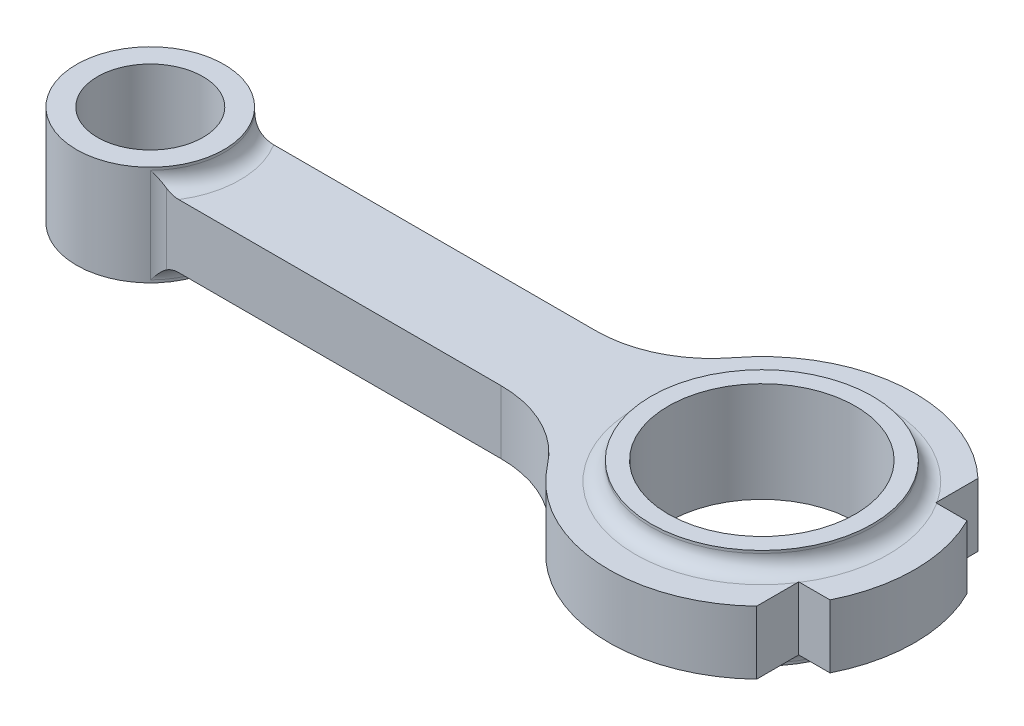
SolidWorks part; units mm, degrees
ref_plane "Front Plane" through (0, 0, 0) normal (0, 0, 1) x (1, 0, 0)
ref_plane "Top Plane" through (0, 0, 0) normal (0, 1, 0) x (1, 0, 0)
ref_plane "Right Plane" through (0, 0, 0) normal (1, 0, 0) x (0, 0, -1)
sketch "Sketch1" plane through (0, 0, 0) normal (0, 1, 0) x (1, 0, 0)
  line L0 (10.7238, 9) -> (75.5031, 9)
  line L1 (10.7238, -9) -> (75.5031, -9)
  line L2 (-1000, 0) -> (49000, 0) construction
  line L4 (136, 21) -> (136, 13)
  line L5 (136, 13) -> (141.923, 13)
  line L7 (136, -13) -> (141.923, -13)
  line L10 (136, -21) -> (136, -13)
  arc A0 (10.7238, 9) -> (10.7238, -9) centre (0, 0) ccw
  arc A1 (92.9723, -17.6275) -> (136, -21) centre (116, 0) ccw
  arc A2 (75.5031, 9) -> (92.9723, 17.6275) centre (75.5031, 31) ccw
  arc A3 (75.5031, -9) -> (92.9723, -17.6275) centre (75.5031, -31) cw
  arc A4 (141.923, -13) -> (141.923, 13) centre (116, 0) ccw
  arc A5 (136, 21) -> (92.9723, 17.6275) centre (116, 0) ccw
  point P1 (0, 0)
  point P20 (0, 0)
  point P21 (0, 0)
  dimension "D1" = 116
  dimension "D2" = 58
  dimension "D3" = 28
  dimension "D4" = 22
  dimension "D5" = 18
  dimension "D7" = 20
  dimension "D9" = 13
extrude "Boss-Extrude1" add sketch "Sketch1" along normal mid plane 12
sketch "Sketch2" plane through (0, 0, 0) normal (0, 1, 0) x (1, 0, 0)
  circle A0 centre (0, 0) radius 14
  circle A1 centre (116, 0) radius 21
  dimension "D1" = 28
  dimension "D4" = 42
  dimension "D3" = 116
extrude "Boss-Extrude2" add sketch "Sketch2" along normal mid plane 19
sketch "Sketch3" plane through (0, 9.5, 0) normal (0, 1, 0) x (1, 0, 0)
  circle A0 centre (0, 0) radius 10
  circle A1 centre (116, 0) radius 17.75
  dimension "D1" = 20
  dimension "D2" = 35.5
extrude "Cut-Extrude1" cut sketch "Sketch3" against normal through all both and the other way through all
fillet "Fillet1" radius 3 6 edges at (10.7238, 0, -9) (10.7238, 0, 9) (14, 6, 0) (14, -6, 0) (116, -6, 21) (116, 6, 21)
